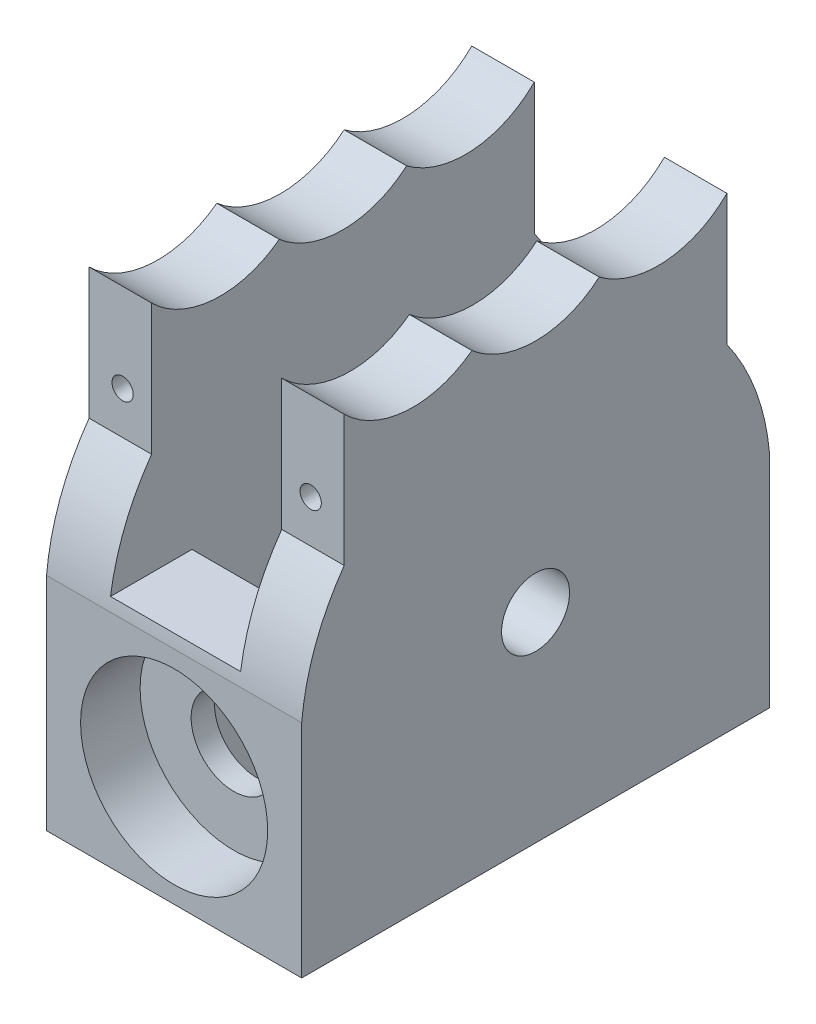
SolidWorks part; units mm, degrees
ref_plane "Front Plane" through (0, 0, 0) normal (0, 0, 1) x (1, 0, 0)
ref_plane "Top Plane" through (0, 0, 0) normal (0, 1, 0) x (1, 0, 0)
ref_plane "Right Plane" through (0, 0, 0) normal (1, 0, 0) x (0, 0, -1)
sketch "Sketch1" plane through (0, 0, 0) normal (0, 0, 1) x (1, 0, 0)
  line L1 (-15, -13) -> (15, -13)
  line L2 (-15, -13) -> (-15, 13)
  line L3 (-15, 13) -> (15, 13)
  line L4 (15, -13) -> (15, 13)
  line L5 (-15, -13) -> (15, 13) construction
  line L6 (-15, 13) -> (15, -13) construction
  point P0 (0, 0)
  dimension "D1" = 30
  dimension "D2" = 26
extrude "Boss-Extrude1" add sketch "Sketch1" along normal mid plane 55
sketch "Sketch3" plane through (0, 0, 27.5) normal (0, 0, 1) x (1, 0, 0)
  circle A0 centre (0, 0) radius 5
extrude "Cut-Extrude1" cut sketch "Sketch3" against normal up to surface (55 mm away)
sketch "Sketch4" plane through (0, 0, 27.5) normal (0, 0, 1) x (1, 0, 0)
  circle A0 centre (0, 0) radius 11
extrude "Cut-Extrude2" cut sketch "Sketch4" against normal blind 7
mirror "Mirror1" about plane through (0, 0, 0) normal (0, 0, 1) of "Cut-Extrude2"
sketch "Sketch7" plane through (-15, 0, 0) normal (-1, 0, 0) x (0, 0, 1)
  line L0 (27.5, 13) -> (-27.5, 13) construction
  line L2 (27.5, 13) -> (-27.5, 13)
  line L3 (0, -55) -> (0, 55) construction
  arc A0 (27.5, 13) -> (-27.5, 13) centre (0, 10.5) ccw
  point P0 (-27.5, 13)
  point P1 (25, 13)
extrude "Boss-Extrude2" add sketch "Sketch7" against normal up to surface (30 mm away)
sketch "Sketch10" plane through (-15, 0, 0) normal (-1, 0, 0) x (0, 0, 1)
  circle A0 centre (0, 10.5) radius 4
  point P2 (0, 0)
  dimension "D1" = 0
extrude "Cut-Extrude5" cut sketch "Sketch10" against normal through all
sketch "Sketch8" plane through (-15, 0, 0) normal (-1, 0, 0) x (0, 0, 1)
  line L0 (0.9146, 7.9872) -> (-10.063, 38.1478) construction
  line L1 (0, -16.5) -> (0, 16.5) construction
  line L2 (-22.5, 26.5078) -> (-22.5, 41.9067)
  line L3 (0, 0.2422) -> (0, 29.0223) construction
  line L4 (-27.5, 13) -> (-27.5, -13) construction
  arc A0 (27.5, 13) -> (-27.5, 13) centre (0, 10.5) ccw construction
  arc A1 (27.5, 13) -> (-22.5, 26.5078) centre (0, 10.5) ccw
  circle A2 centre (0, 49.6134) radius 11.5 construction
  circle A3 centre (0, 10.5) radius 30.6134 construction
  circle A4 centre (-14.4036, 50.0737) radius 11.5 construction
  arc A5 (0, 38.1134) -> (-7.4881, 40.8854) centre (0, 49.6134) cw
  arc A6 (-10.4704, 39.2672) -> (-8.2948, 40.3303) centre (-14.4036, 50.0737) ccw
  arc A7 (-22.5, 41.9067) -> (-7.4881, 40.8854) centre (-14.4036, 50.0737) ccw
  arc A8 (-10.4704, 39.2672) -> (-22.5, 41.9067) centre (-14.4036, 50.0737) cw
  dimension "D1" = 20
  dimension "D2" = 23
  dimension "D3" = 23
  dimension "D4" = 3
  dimension "D6" = 5
extrude "Boss-Extrude3" add sketch "Sketch8" against normal up to surface (30 mm away)
mirror "Mirror2" about plane through (0, 0, 0) normal (0, 0, 1) of "Boss-Extrude3"
sketch "Sketch9" plane through (0, -13, 0) normal (0, -1, 0) x (1, 0, 0)
  line L1 (7.65, -17.75) -> (-7.65, -17.75)
  line L2 (7.65, -17.75) -> (7.65, 17.75)
  line L3 (7.65, 17.75) -> (-7.65, 17.75)
  line L4 (-7.65, -17.75) -> (-7.65, 17.75)
  line L5 (7.65, -17.75) -> (-7.65, 17.75) construction
  line L6 (7.65, 17.75) -> (-7.65, -17.75) construction
  point P0 (0, 0)
extrude "Cut-Extrude4" cut sketch "Sketch9" against normal through all
ref_plane "Plane1" through (11, 0, 0) normal (1, 0, 0) x (0, 0, -1)
sketch "Sketch13" plane through (0, 0, 27.5) normal (0, 0, 1) x (1, 0, 0)
  circle A0 centre (11.0566, 31.5042) radius 1.25
extrude "Cut-Extrude8" cut sketch "Sketch13" against normal blind 10
mirror "Mirror4" about plane through (0, 0, 0) normal (1, 0, 0) of "Cut-Extrude8"
sketch "Sketch14" plane through (0, 0, -17.75) normal (0, 0, 1) x (1, 0, 0)
  line L1 (-7.65, 14.4423) -> (7.65, 14.4423)
  line L2 (-7.65, 14.4423) -> (-7.65, 50.7502)
  line L3 (-7.65, 50.7502) -> (7.65, 50.7502)
  line L4 (7.65, 14.4423) -> (7.65, 50.7502)
  line L5 (-7.65, 14.4423) -> (7.65, 50.7502) construction
  line L6 (-7.65, 50.7502) -> (7.65, 14.4423) construction
  point P0 (0, 32.5963)
  point P5 (0, 0)
  point P6 (0, 0)
extrude "Cut-Extrude9" cut sketch "Sketch14" against normal through all both and the other way through all
